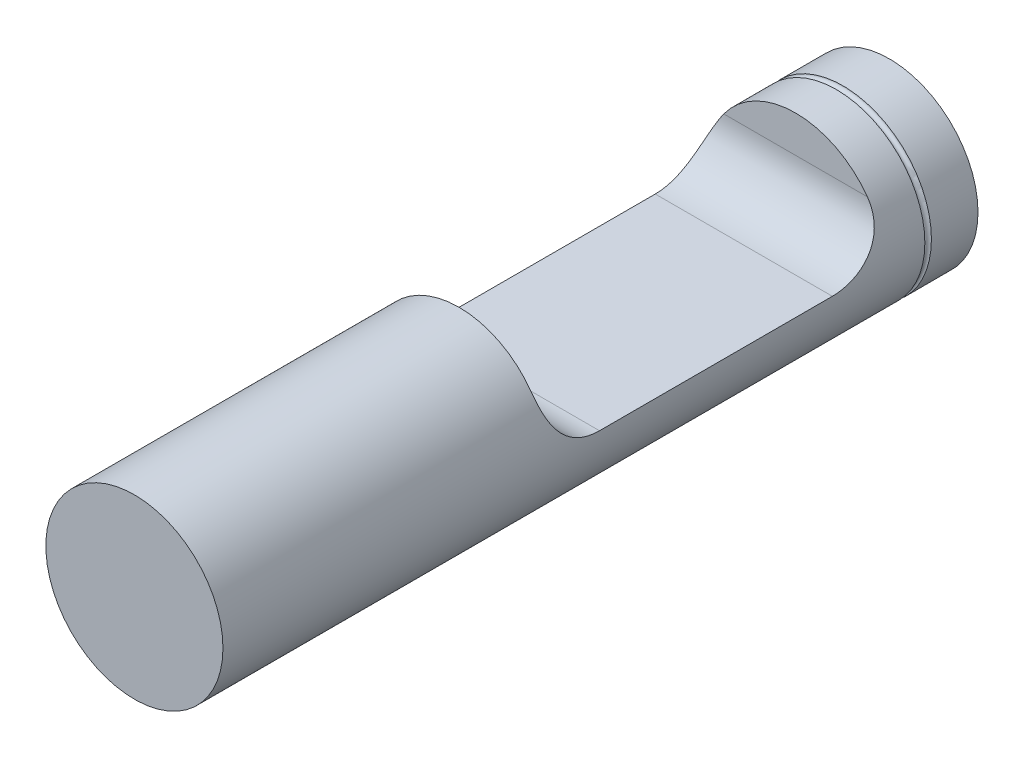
SolidWorks part; units mm, degrees
ref_plane "Front Plane" through (0, 0, 0) normal (0, 0, 1) x (1, 0, 0)
ref_plane "Top Plane" through (0, 0, 0) normal (0, 1, 0) x (1, 0, 0)
ref_plane "Right Plane" through (0, 0, 0) normal (1, 0, 0) x (0, 0, -1)
sketch "Sketch1" plane through (0, 0, 0) normal (0, 0, 1) x (1, 0, 0)
  circle A0 centre (0, 0) radius 1.35
  dimension "D1" = 2.7
extrude "Boss-Extrude1" add sketch "Sketch1" against normal blind 11.51
sketch "Sketch2" plane through (0, 0, 0) normal (0, 1, 0) x (1, 0, 0)
  line L0 (0, 0) -> (0, 4.95) construction
  line L1 (-1.9, 10.08) -> (1.9, 10.08)
  line L2 (-1.9, 10.08) -> (-1.9, 4.95)
  line L3 (-1.9, 4.95) -> (1.9, 4.95)
  line L4 (1.9, 10.08) -> (1.9, 4.95)
  dimension "D1" = 4.95
  dimension "D2" = 5.13
  dimension "D3" = 3.8
extrude "Cut-Extrude1" cut sketch "Sketch2" along normal up to next
fillet "Fillet1" radius 0.79 2 edges at (0, 0, -10.08) (0, 0, -4.95)
sketch "Sketch3" plane through (0, 0, 0) normal (1, 0, 0) x (0, 0, -1)
  line L0 (11.51, 1.35) -> (10.08, 1.35) construction
  line L1 (11.51, -1.35) -> (11.51, 1.35) construction
  line L2 (0, 0) -> (11.51, 0) construction
  circle A0 centre (10.75, 1.35) radius 0.05
  dimension "D1" = 0.1
  dimension "D2" = 0.76
revolve "Cut-Revolve1" cut sketch "Sketch3" angle 360 about L2
